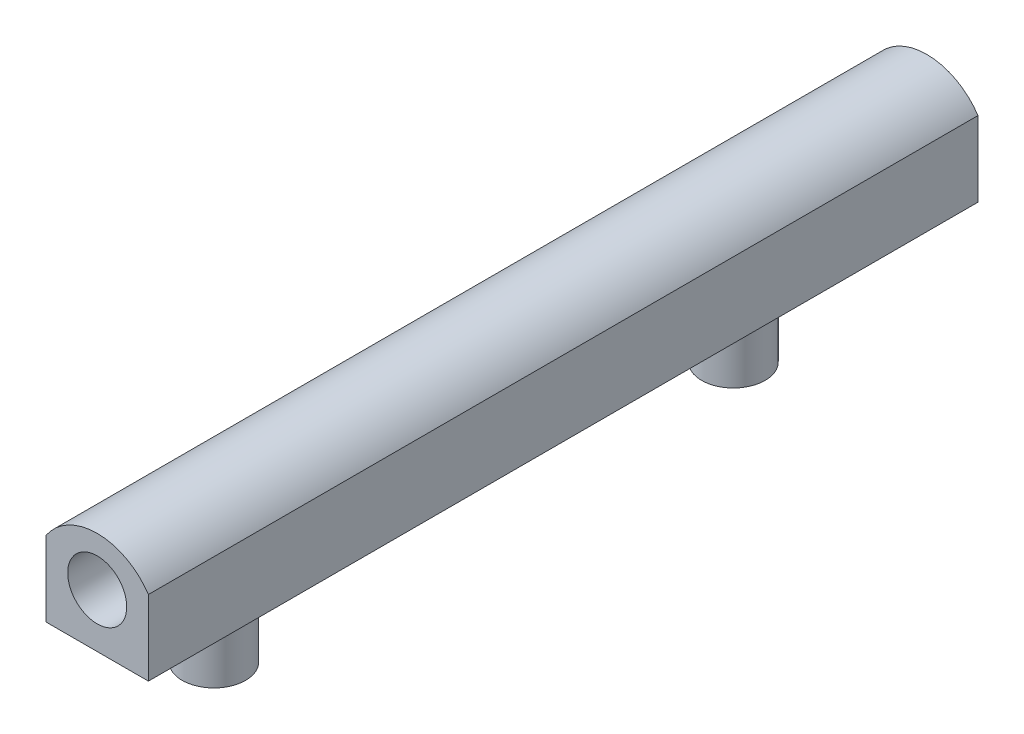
SolidWorks part; units mm, degrees
ref_plane "Front Plane" through (0, 0, 0) normal (0, 0, 1) x (1, 0, 0)
ref_plane "Top Plane" through (0, 0, 0) normal (0, 1, 0) x (1, 0, 0)
ref_plane "Right Plane" through (0, 0, 0) normal (1, 0, 0) x (0, 0, -1)
sketch "Sketch2" plane through (0, 0, 0) normal (0, 0, 1) x (1, 0, 0)
  line L0 (-2.0066, 0.8449) -> (-2.0066, -2.0955)
  line L1 (-2.0066, -2.0955) -> (2.0066, -2.0955)
  line L2 (2.0066, -2.0955) -> (2.0066, 0.8449)
  circle A0 centre (0, 0) radius 1.1557
  arc A1 (-2.0066, 0.8449) -> (2.0066, 0.8449) centre (0, -0.4953) cw
  point P7 (0, -2.0955)
  point P9 (0, 1.9177)
  point P11 (0, 1.1557)
  point P12 (0, -1.1557)
  dimension "D1" = 2.3114
  dimension "D2" = 2.413
  dimension "D3" = 4.0132
  dimension "D4" = 4.0132
  dimension "D5" = 0.762
extrude "Boss-Extrude1" add sketch "Sketch2" against normal blind 32.512
ref_plane "Plane1" through (0, 0, -4.572) normal (0, 0, -1) x (-1, 0, 0)
sketch "Sketch3" plane through (0, 0, -4.572) normal (0, 0, -1) x (-1, 0, 0)
  circle A0 centre (0, 0) radius 1.3843
  dimension "D1" = 2.7686
extrude "Cut-Extrude1" cut sketch "Sketch3" along normal blind 32.512
fillet "Fillet1" radius 0.127 1 edges at (-1.3843, 0, -4.572)
sketch "Sketch4" plane through (0, -2.0955, 0) normal (0, -1, 0) x (1, 0, 0)
  line L0 (-2.2073, -4.572) -> (2.2073, -4.572) construction
  circle A0 centre (0, -4.572) radius 1.2446
  circle A1 centre (0, -24.9326) radius 1.2446
  dimension "D2" = 2.4892
  dimension "D1" = 20.3606
extrude "Boss-Extrude2" add sketch "Sketch4" along normal blind 2.6416
hole_wizard "#97 (0.0059) Diameter Hole1" positions "Sketch8" profile "Sketch7" hole size "#97" standard "Ansi Inch"
sketch "Sketch8" plane through (0, -4.7371, 0) normal (0, -1, 0) x (1, 0, 0)
  point P7 (0, -24.9326)
  point P14 (0, -4.572)
sketch "Sketch7" plane through (0, -4.7371, -24.9326) normal (1, 0, 0) x (0, 0, -1)
  line L0 (0, 0) -> (0, 1.9055)
  line L1 (0, 1.9055) -> (0.635, 1.524)
  line L2 (0.635, 1.524) -> (0.635, 0)
  line L5 (0.635, 0) -> (0, 0)
  line L10 (0, 1.9055) -> (-0.635, 1.524) construction
  line L11 (0, -6.35) -> (0, 107.95) construction
  dimension "Hole Dia." = 1.27
  dimension "Hole Depth" = 1.524
  dimension "Drill Angle" = 118
fillet "Fillet2" radius 0.381 2 edges at (0, -2.0955, -26.1772) (0, -2.0955, -5.8166)
